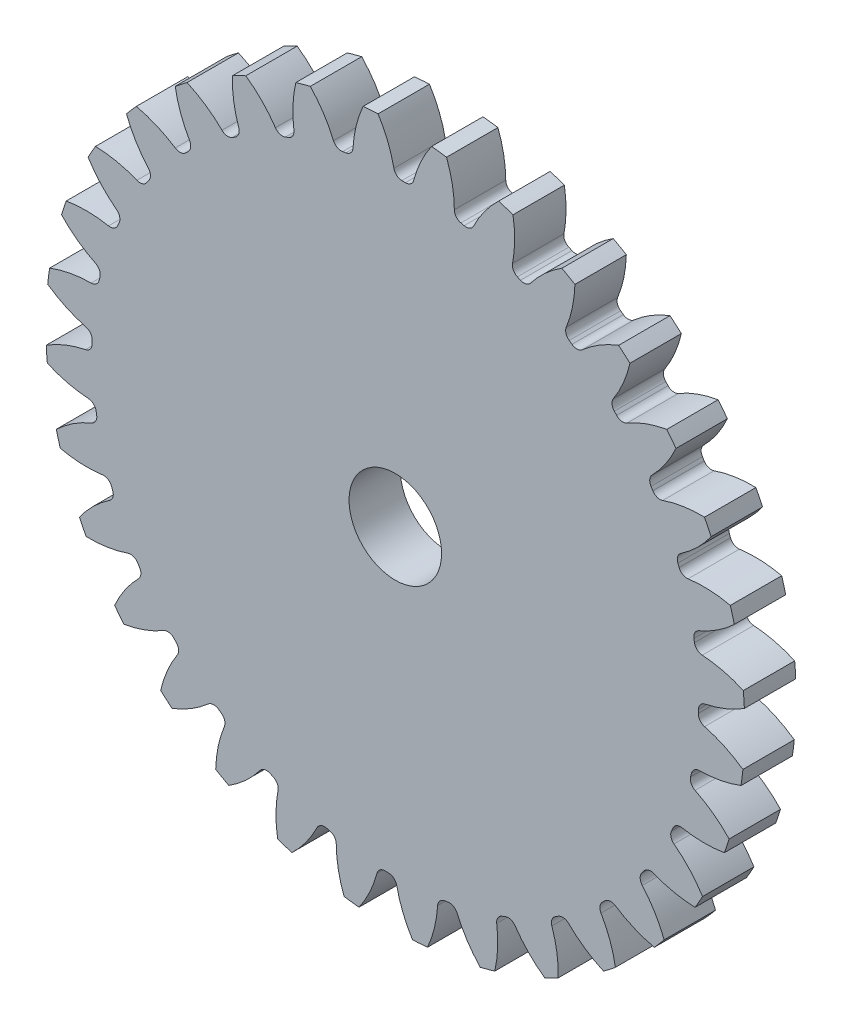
SolidWorks part; units mm, degrees
ref_plane "Front" through (0, 0, 0) normal (0, 0, 1) x (1, 0, 0)
ref_plane "Top" through (0, 0, 0) normal (0, 1, 0) x (1, 0, 0)
ref_plane "Right" through (0, 0, 0) normal (1, 0, 0) x (0, 0, -1)
sketch "Sketch3" plane through (0, 0, 0) normal (0, 0, 1) x (1, 0, 0)
  circle A0 centre (0, 0) radius 863.6
  dimension "od" = 1727.2
extrude "gearBody" add sketch "Sketch3" along normal blind 127
sketch "Sketch2" plane through (0, 0, 0) normal (0, 0, 1) x (1, 0, 0)
  line L0 (0, 0) -> (705.6427, 292.2868) construction
  line L1 (859.942, -90.3948) -> (0, 0) construction
  line L2 (0, 0) -> (36.3143, 0) construction
  line L3 (812.6133, 17.4221) -> (810.4424, -61.8626) construction
  line L5 (811.5278, -22.2203) -> (0, 0) construction
  line L7 (0, 0) -> (763.7822, 0) construction
  arc A0 (763.7758, 3.1262) -> (762.4603, -44.9157) centre (0, 0) ccw construction
  arc A1 (862.5516, 42.5411) -> (858.9313, -89.6766) centre (0, 0) ccw construction
  arc A2 (812.6133, 17.4221) -> (810.4424, -61.8626) centre (0, 0) ccw construction
  arc A3 (748.8921, -24.7196) -> (749.1227, -16.2972) centre (0, 0) ccw
  arc A4 (859.942, -90.3948) -> (764.2527, -45.3854) centre (688.5914, -330.462) ccw
  arc A5 (859.942, -90.3948) -> (863.6, 43.2029) centre (0, 0) ccw
  arc A6 (863.6, 43.2029) -> (765.5911, 3.4971) centre (705.6427, 292.2868) cw
  arc A7 (749.1227, -16.2972) -> (765.5911, 3.4971) centre (769.7935, -16.7469) cw
  arc A8 (764.2527, -45.3854) -> (748.8921, -24.7196) centre (769.5565, -25.4017) cw
  point P6 (863.6, 43.2029)
  point P22 (859.942, -90.3948)
  dimension "baseDia" = 1527.5643
  dimension "od" = 1727.2
  dimension "pd" = 1625.6
  dimension "rd" = 1498.6
  dimension "rFillet" = 20.6756
  dimension "pointX" = 863.6
  dimension "pointY" = 43.2029
  dimension "CTT" = 79.2847
  dimension "flankCenterAngle" = 22.5
extrude "toothCut" cut sketch "Sketch2" along normal through all
pattern_circular "CirPattern1" count 32 over 360 about axis through (0, 0, 0) along (0, 0, 1) of "toothCut"
sketch "hub1Dia" plane through (0, 0, 0) normal (0, 0, -1) x (-1, 0, 0)
  circle A0 centre (0, 0) radius 12.7
  dimension "hub1Dia" = 25.4
sketch "hub2Dia" plane through (0, 0, 127) normal (0, 0, 1) x (1, 0, 0)
  circle A0 centre (0, 0) radius 12.7
  dimension "hub2dia" = 25.4
sketch "boreDia" plane through (0, 0, 0) normal (0, 0, 1) x (1, 0, 0)
  circle A0 centre (0, 0) radius 114.3
  dimension "boreDia" = 228.6
extrude "bore" cut sketch "boreDia" against normal mid plane 25400
